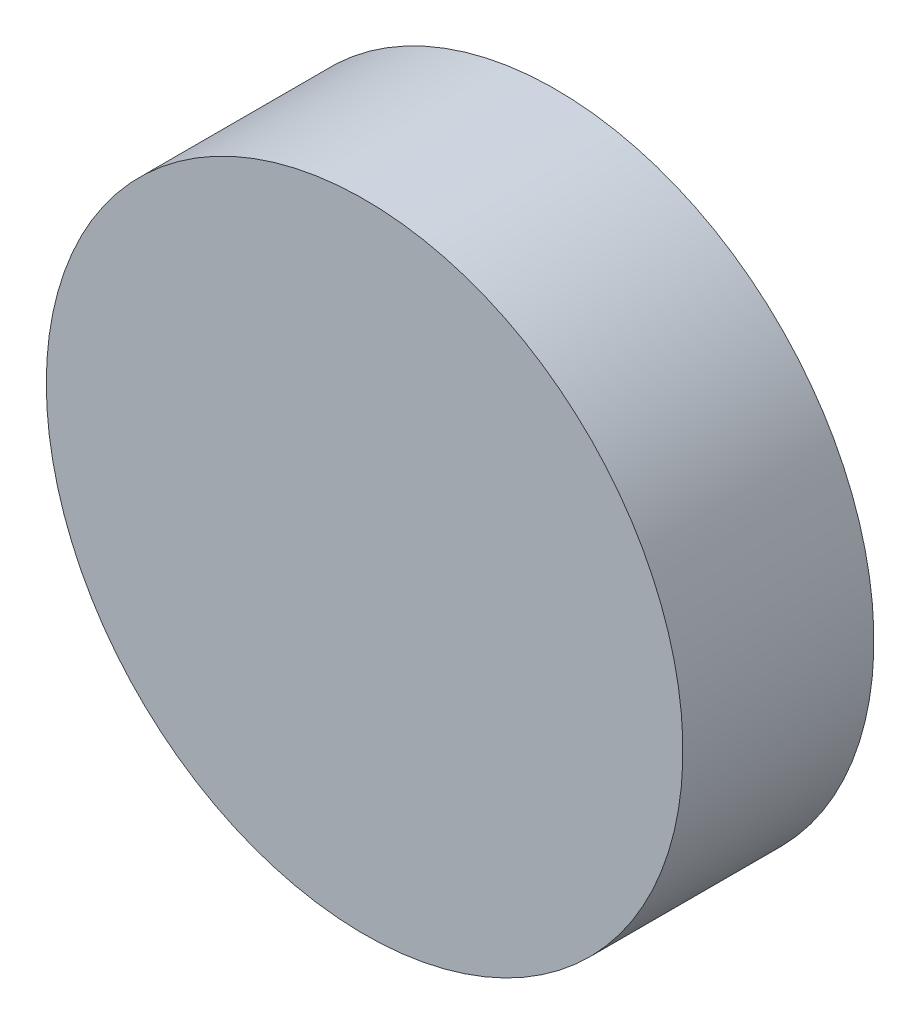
SolidWorks part; units mm, degrees
ref_plane "Plane1" through (0, 0, 0) normal (0, 0, 1) x (1, 0, 0)
ref_plane "Plane2" through (0, 0, 0) normal (0, 1, 0) x (1, 0, 0)
ref_plane "Plane3" through (0, 0, 0) normal (1, 0, 0) x (0, 0, -1)
sketch "Sketch2" plane through (0, 0, 0) normal (0, 0, 1) x (1, 0, 0)
  circle A0 centre (0, 0) radius 15.875
  dimension "D1" = 31.75
extrude "Base-Extrude" add sketch "Sketch2" along normal blind 9.525
